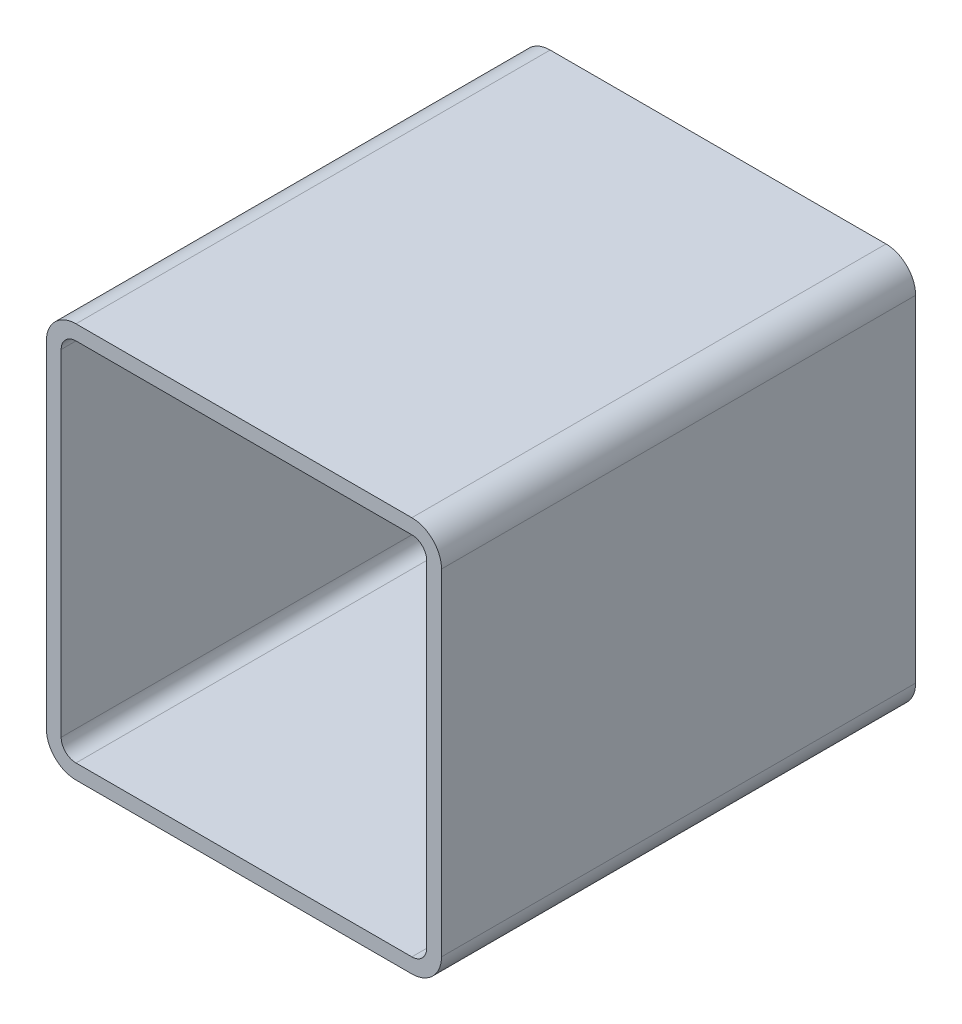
SolidWorks part; units mm, degrees
ref_plane "Front Plane" through (0, 0, 0) normal (0, 0, 1) x (1, 0, 0)
ref_plane "Top Plane" through (0, 0, 0) normal (0, 1, 0) x (1, 0, 0)
ref_plane "Right Plane" through (0, 0, 0) normal (1, 0, 0) x (0, 0, -1)
sketch "Sketch1" plane through (0, 0, 0) normal (0, 0, 1) x (1, 0, 0)
sketch_block_instance "HSS10x10x0.375-1"
sketch_block "HSS10x10x0.375"
extrude "Boss-Extrude1" add sketch "Sketch1" along normal blind 304.8
